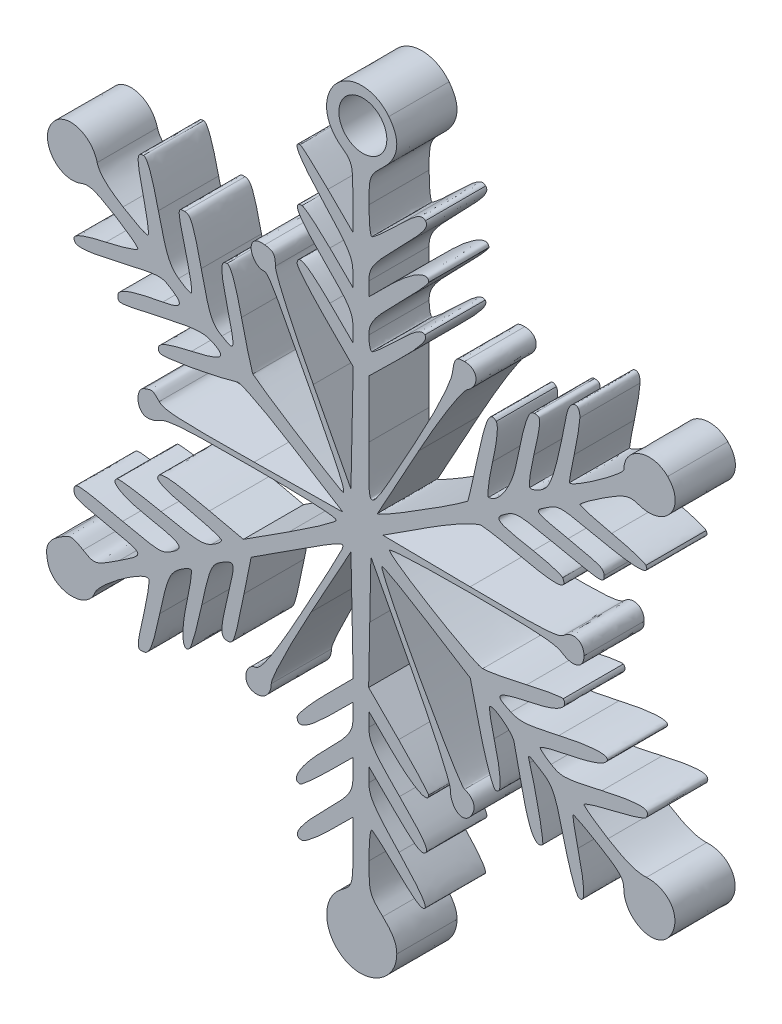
SolidWorks part; units mm, degrees
ref_plane "Front Plane" through (0, 0, 0) normal (0, 0, 1) x (1, 0, 0)
ref_plane "Top Plane" through (0, 0, 0) normal (0, 1, 0) x (1, 0, 0)
ref_plane "Right Plane" through (0, 0, 0) normal (1, 0, 0) x (0, 0, -1)
sketch "Model" plane through (0, 0, 0) normal (0, 0, 1) x (1, 0, 0)
  line L0 (27.5578, 9.3179) -> (27.5578, 11.3104)
  line L1 (27.5578, 11.3104) -> (26.0288, 9.7973)
  line L2 (27.5578, 13.6934) -> (27.5578, 14.7512)
  line L3 (27.5578, 14.7512) -> (25.897, 13.1052)
  line L4 (27.5578, 17.0001) -> (27.5578, 17.9249)
  line L5 (27.5578, 17.9249) -> (26.0288, 16.4119)
  line L6 (25.7135, 17.4202) -> (27.5734, 19.2926)
  line L7 (27.5734, 19.2926) -> (27.4994, 22.8982)
  line L8 (27.4994, 22.8982) -> (27.4255, 26.5037)
  line L9 (27.4255, 26.5037) -> (24.7797, 21.7193)
  line L10 (22.9202, 24.2573) -> (20.7962, 22.8796)
  line L11 (20.7962, 22.8796) -> (20.3236, 20.5429)
  line L12 (18.0327, 24.1638) -> (20.2817, 23.6528)
  line L13 (20.2817, 23.6528) -> (23.3169, 25.6034)
  line L14 (20.9953, 28.4536) -> (26.8959, 28.5248)
  line L15 (26.8959, 28.5248) -> (23.6059, 30.5775)
  line L16 (24.9227, 34.8786) -> (27.4255, 30.1199)
  line L17 (27.4255, 30.1199) -> (27.4997, 33.6736)
  line L18 (27.4997, 33.6736) -> (27.5739, 37.2274)
  line L19 (27.5739, 37.2274) -> (25.7138, 39.1)
  line L20 (26.0288, 40.1086) -> (27.5578, 38.5955)
  line L21 (27.5578, 38.5955) -> (27.5578, 39.5203)
  line L22 (26.0288, 43.2836) -> (27.5578, 41.7705)
  line L23 (27.5578, 41.7705) -> (27.5538, 42.6883)
  line L24 (25.897, 46.5902) -> (27.5578, 44.9442)
  line L25 (27.5578, 44.9442) -> (27.5578, 46.9373)
  line L26 (28.6161, 42.6824) -> (28.6161, 41.7705)
  line L27 (28.6161, 41.7705) -> (30.1452, 43.2836)
  line L28 (30.6219, 39.1883) -> (28.6161, 37.2211)
  line L29 (28.6161, 37.2211) -> (28.6161, 33.4094)
  line L30 (32.5184, 30.443) -> (29.5495, 28.5248)
  line L31 (29.5495, 28.5248) -> (35.34, 28.4534)
  line L32 (36.0176, 20.463) -> (35.3494, 23.2086)
  line L33 (35.3494, 23.2086) -> (32.4803, 25.0194)
  line L34 (31.3846, 21.8829) -> (28.7484, 26.8825)
  line L35 (28.7484, 26.8825) -> (28.6747, 23.0869)
  line L36 (28.6747, 23.0869) -> (28.601, 19.2914)
  line L37 (28.601, 19.2914) -> (30.593, 17.2877)
  line L38 (30.1452, 16.4119) -> (28.6162, 17.9249)
  line L39 (28.6162, 17.9249) -> (28.6162, 17.013)
  line L40 (30.3332, 13.0495) -> (28.6162, 14.7512)
  line L41 (28.6162, 14.7512) -> (28.6212, 13.8328)
  line L42 (0.1159, 55.7641) -> (55.7641, 55.7641)
  line L43 (55.7641, 55.7641) -> (55.7641, 0.1159)
  line L44 (55.7641, 0.1159) -> (0.1159, 0.1159)
  line L45 (0.1159, 0.1159) -> (0.1159, 55.7641)
  spline S0 degree 3 poles (26.999, 2.8494) (25.5131, 3.6801) (25.4069, 5.7352) (26.7968, 6.7628) knots 0 0 0 0 1 1 1 1
  spline S1 degree 3 poles (26.7968, 6.7628) (27.5179, 7.2959) (27.5578, 7.4299) (27.5578, 9.3179) knots 0 0 0 0 1 1 1 1
  spline S2 degree 3 poles (26.0288, 9.7973) (25.1878, 8.9651) (24.3544, 8.2842) (24.1767, 8.2842) knots 0 0 0 0 1 1 1 1
  spline S3 degree 3 poles (24.1767, 8.2842) (23.4749, 8.2842) (23.9351, 9.0407) (25.7057, 10.7978) knots 0 0 0 0 1 1 1 1
  spline S4 degree 3 poles (25.7057, 10.7978) (27.3835, 12.4626) (27.5578, 12.7352) (27.5578, 13.6934) knots 0 0 0 0 1 1 1 1
  spline S5 degree 3 poles (25.897, 13.1052) (24.9836, 12.1999) (24.1502, 11.4592) (24.0449, 11.4592) knots 0 0 0 0 1 1 1 1
  spline S6 degree 3 poles (24.0449, 11.4592) (23.3944, 11.4592) (24.1064, 12.6503) (25.7057, 14.2373) knots 0 0 0 0 1 1 1 1
  spline S7 degree 3 poles (25.7057, 14.2373) (27.295, 15.8145) (27.5578, 16.2064) (27.5578, 17.0001) knots 0 0 0 0 1 1 1 1
  spline S8 degree 3 poles (26.0288, 16.4119) (24.5394, 14.9381) (23.8536, 14.5633) (23.8536, 15.2233) knots 0 0 0 0 1 1 1 1
  spline S9 degree 3 poles (23.8536, 15.2233) (23.8536, 15.4018) (24.6906, 16.3904) (25.7135, 17.4202) knots 0 0 0 0 1 1 1 1
  spline S10 degree 3 poles (24.7797, 21.7193) (23.3245, 19.0879) (22.1338, 16.6392) (22.1338, 16.2778) knots 0 0 0 0 1 1 1 1
  spline S11 degree 3 poles (22.1338, 16.2778) (22.1338, 15.5157) (21.4801, 15.0023) (20.8283, 15.2524) knots 0 0 0 0 1 1 1 1
  spline S12 degree 3 poles (20.8283, 15.2524) (20.2016, 15.4929) (20.3905, 16.596) (21.0755, 16.6954) knots 0 0 0 0 1 1 1 1
  spline S13 degree 3 poles (21.0755, 16.6954) (21.4574, 16.7509) (22.3043, 18.0355) (24.1182, 21.3107) knots 0 0 0 0 1 1 1 1
  spline S14 degree 3 poles (24.1182, 21.3107) (25.5007, 23.8068) (26.7207, 26.0736) (26.8295, 26.3482) knots 0 0 0 0 1 1 1 1
  spline S15 degree 3 poles (26.8295, 26.3482) (27.0546, 26.9164) (26.8565, 26.8104) (22.9202, 24.2573) knots 0 0 0 0 1 1 1 1
  spline S16 degree 3 poles (20.3236, 20.5429) (19.6919, 17.4194) (19.6441, 17.2801) (19.2056, 17.2801) knots 0 0 0 0 1 1 1 1
  spline S17 degree 3 poles (19.2056, 17.2801) (18.7356, 17.2801) (18.7402, 17.7703) (19.2287, 19.7936) knots 0 0 0 0 1 1 1 1
  spline S18 degree 3 poles (19.2287, 19.7936) (19.7778, 22.0678) (19.7599, 22.155) (18.8542, 21.6199) knots 0 0 0 0 1 1 1 1
  spline S19 degree 3 poles (18.8542, 21.6199) (18.1697, 21.2156) (18.0277, 20.8835) (17.5197, 18.4978) knots 0 0 0 0 1 1 1 1
  spline S20 degree 3 poles (17.5197, 18.4978) (17.2071, 17.0295) (16.8413, 15.7182) (16.7069, 15.5838) knots 0 0 0 0 1 1 1 1
  spline S21 degree 3 poles (16.7069, 15.5838) (16.2054, 15.0822) (16.1182, 16.307) (16.5239, 18.1559) knots 0 0 0 0 1 1 1 1
  spline S22 degree 3 poles (16.5239, 18.1559) (16.7524, 19.1972) (16.8857, 20.1028) (16.8203, 20.1683) knots 0 0 0 0 1 1 1 1
  spline S23 degree 3 poles (16.8203, 20.1683) (16.7548, 20.2338) (16.3815, 20.0487) (15.9908, 19.757) knots 0 0 0 0 1 1 1 1
  spline S24 degree 3 poles (15.9908, 19.757) (15.3959, 19.3128) (15.1908, 18.8002) (14.7283, 16.6014) knots 0 0 0 0 1 1 1 1
  spline S25 degree 3 poles (14.7283, 16.6014) (14.3094, 14.6101) (14.0666, 13.955) (13.7231, 13.8889) knots 0 0 0 0 1 1 1 1
  spline S26 degree 3 poles (13.7231, 13.8889) (13.1676, 13.7819) (13.1669, 13.8472) (13.6987, 16.2018) knots 0 0 0 0 1 1 1 1
  spline S27 degree 3 poles (13.6987, 16.2018) (13.9343, 17.2452) (14.0653, 18.1607) (13.9898, 18.2362) knots 0 0 0 0 1 1 1 1
  spline S28 degree 3 poles (13.9898, 18.2362) (13.6854, 18.5406) (10.703, 16.3871) (10.4309, 15.6664) knots 0 0 0 0 1 1 1 1
  spline S29 degree 3 poles (10.4309, 15.6664) (9.908, 14.281) (7.6541, 14.388) (7.2959, 15.8153) knots 0 0 0 0 1 1 1 1
  spline S30 degree 3 poles (7.2959, 15.8153) (7.0739, 16.6997) (7.2726, 17.152) (8.1296, 17.7136) knots 0 0 0 0 1 1 1 1
  spline S31 degree 3 poles (8.1296, 17.7136) (8.8026, 18.1545) (8.8785, 18.1548) (9.6368, 17.7195) knots 0 0 0 0 1 1 1 1
  spline S32 degree 3 poles (9.6368, 17.7195) (10.4338, 17.2622) (10.4387, 17.2634) (12.0404, 18.316) knots 0 0 0 0 1 1 1 1
  spline S33 degree 3 poles (12.0404, 18.316) (13.7655, 19.4496) (13.7733, 19.4295) (11.4181, 19.9284) knots 0 0 0 0 1 1 1 1
  spline S34 degree 3 poles (11.4181, 19.9284) (9.1967, 20.399) (9.0369, 20.4621) (9.0369, 20.8697) knots 0 0 0 0 1 1 1 1
  spline S35 degree 3 poles (9.0369, 20.8697) (9.0369, 21.3661) (9.2374, 21.3544) (12.2629, 20.6808) knots 0 0 0 0 1 1 1 1
  spline S36 degree 3 poles (12.2629, 20.6808) (14.7275, 20.132) (14.8552, 20.1279) (15.5389, 20.5759) knots 0 0 0 0 1 1 1 1
  spline S37 degree 3 poles (15.5389, 20.5759) (16.4283, 21.1586) (16.1568, 21.3581) (13.8927, 21.7853) knots 0 0 0 0 1 1 1 1
  spline S38 degree 3 poles (13.8927, 21.7853) (12.3091, 22.0841) (11.3807, 22.6184) (11.8939, 22.9355) knots 0 0 0 0 1 1 1 1
  spline S39 degree 3 poles (11.8939, 22.9355) (12.0242, 23.0161) (13.3388, 22.8275) (14.8153, 22.5165) knots 0 0 0 0 1 1 1 1
  spline S40 degree 3 poles (14.8153, 22.5165) (17.126, 22.0299) (17.5923, 22.0006) (18.1632, 22.3061) knots 0 0 0 0 1 1 1 1
  spline S41 degree 3 poles (18.1632, 22.3061) (18.528, 22.5014) (18.8265, 22.7542) (18.8265, 22.8681) knots 0 0 0 0 1 1 1 1
  spline S42 degree 3 poles (18.8265, 22.8681) (18.8265, 22.9819) (17.874, 23.2797) (16.7098, 23.5299) knots 0 0 0 0 1 1 1 1
  spline S43 degree 3 poles (16.7098, 23.5299) (15.3533, 23.8214) (14.5931, 24.1111) (14.5931, 24.3365) knots 0 0 0 0 1 1 1 1
  spline S44 degree 3 poles (14.5931, 24.3365) (14.5931, 24.8096) (15.3597, 24.7711) (18.0327, 24.1638) knots 0 0 0 0 1 1 1 1
  spline S45 degree 3 poles (23.3169, 25.6034) (24.9863, 26.6761) (26.3933, 27.6774) (26.4436, 27.8284) knots 0 0 0 0 1 1 1 1
  spline S46 degree 3 poles (26.4436, 27.8284) (26.505, 28.0121) (24.6849, 28.1037) (20.9365, 28.1054) knots 0 0 0 0 1 1 1 1
  spline S47 degree 3 poles (20.9365, 28.1054) (16.4274, 28.1074) (15.2212, 28.0315) (14.7382, 27.7151) knots 0 0 0 0 1 1 1 1
  spline S48 degree 3 poles (14.7382, 27.7151) (14.4084, 27.499) (13.9432, 27.3972) (13.7044, 27.4888) knots 0 0 0 0 1 1 1 1
  spline S49 degree 3 poles (13.7044, 27.4888) (13.1497, 27.7016) (13.1383, 28.8144) (13.6888, 29.0257) knots 0 0 0 0 1 1 1 1
  spline S50 degree 3 poles (13.6888, 29.0257) (14.2479, 29.2402) (14.2334, 29.2437) (14.6928, 28.7843) knots 0 0 0 0 1 1 1 1
  spline S51 degree 3 poles (14.6928, 28.7843) (15.0328, 28.4443) (16.0039, 28.3933) (20.9953, 28.4536) knots 0 0 0 0 1 1 1 1
  spline S52 degree 3 poles (23.6059, 30.5775) (21.7963, 31.7066) (20.1296, 32.574) (19.9019, 32.5052) knots 0 0 0 0 1 1 1 1
  spline S53 degree 3 poles (19.9019, 32.5052) (18.2169, 31.9959) (14.8275, 31.4025) (14.708, 31.5958) knots 0 0 0 0 1 1 1 1
  spline S54 degree 3 poles (14.708, 31.5958) (14.4198, 32.0621) (14.8866, 32.3145) (16.8412, 32.7494) knots 0 0 0 0 1 1 1 1
  spline S55 degree 3 poles (16.8412, 32.7494) (18.9401, 33.2163) (19.2454, 33.5046) (18.1632, 33.9977) knots 0 0 0 0 1 1 1 1
  spline S56 degree 3 poles (18.1632, 33.9977) (17.6331, 34.2392) (16.982, 34.1846) (14.9221, 33.726) knots 0 0 0 0 1 1 1 1
  spline S57 degree 3 poles (14.9221, 33.726) (11.8691, 33.0462) (11.9473, 33.051) (11.9473, 33.5417) knots 0 0 0 0 1 1 1 1
  spline S58 degree 3 poles (11.9473, 33.5417) (11.9473, 33.9215) (12.8616, 34.2537) (14.9268, 34.624) knots 0 0 0 0 1 1 1 1
  spline S59 degree 3 poles (14.9268, 34.624) (16.2022, 34.8527) (16.3414, 35.1054) (15.4971, 35.6587) knots 0 0 0 0 1 1 1 1
  spline S60 degree 3 poles (15.4971, 35.6587) (14.8563, 36.0785) (14.6837, 36.0727) (12.4367, 35.5554) knots 0 0 0 0 1 1 1 1
  spline S61 degree 3 poles (12.4367, 35.5554) (9.6458, 34.9128) (9.0369, 34.8788) (9.0369, 35.3657) knots 0 0 0 0 1 1 1 1
  spline S62 degree 3 poles (9.0369, 35.3657) (9.0369, 35.5994) (9.7739, 35.8835) (11.1536, 36.1816) knots 0 0 0 0 1 1 1 1
  spline S63 degree 3 poles (11.1536, 36.1816) (12.3178, 36.4331) (13.2703, 36.7394) (13.2703, 36.8622) knots 0 0 0 0 1 1 1 1
  spline S64 degree 3 poles (13.2703, 36.8622) (13.2703, 36.985) (12.5676, 37.5122) (11.7088, 38.034) knots 0 0 0 0 1 1 1 1
  spline S65 degree 3 poles (11.7088, 38.034) (10.4299, 38.8108) (10.0302, 38.9379) (9.4999, 38.7363) knots 0 0 0 0 1 1 1 1
  spline S66 degree 3 poles (9.4999, 38.7363) (8.0259, 38.1759) (6.6759, 39.8793) (7.544, 41.2043) knots 0 0 0 0 1 1 1 1
  spline S67 degree 3 poles (7.544, 41.2043) (8.3465, 42.4291) (10.1661, 41.9882) (10.5719, 40.4706) knots 0 0 0 0 1 1 1 1
  spline S68 degree 3 poles (10.5719, 40.4706) (10.7133, 39.9419) (11.2258, 39.4362) (12.2893, 38.776) knots 0 0 0 0 1 1 1 1
  spline S69 degree 3 poles (12.2893, 38.776) (13.123, 38.2585) (13.8693, 37.8991) (13.9476, 37.9774) knots 0 0 0 0 1 1 1 1
  spline S70 degree 3 poles (13.9476, 37.9774) (14.0259, 38.0557) (13.9056, 38.9151) (13.6801, 39.8872) knots 0 0 0 0 1 1 1 1
  spline S71 degree 3 poles (13.6801, 39.8872) (13.1751, 42.0648) (13.17, 42.4154) (13.6434, 42.4154) knots 0 0 0 0 1 1 1 1
  spline S72 degree 3 poles (13.6434, 42.4154) (13.8993, 42.4154) (14.211, 41.5722) (14.6356, 39.7315) knots 0 0 0 0 1 1 1 1
  spline S73 degree 3 poles (14.6356, 39.7315) (15.1508, 37.4977) (15.376, 36.957) (15.9779, 36.508) knots 0 0 0 0 1 1 1 1
  spline S74 degree 3 poles (15.9779, 36.508) (16.3758, 36.2113) (16.7579, 36.0252) (16.8271, 36.0944) knots 0 0 0 0 1 1 1 1
  spline S75 degree 3 poles (16.8271, 36.0944) (16.8963, 36.1636) (16.7914, 36.87) (16.594, 37.6642) knots 0 0 0 0 1 1 1 1
  spline S76 degree 3 poles (16.594, 37.6642) (15.8631, 40.6047) (15.8661, 40.5633) (16.3903, 40.5633) knots 0 0 0 0 1 1 1 1
  spline S77 degree 3 poles (16.3903, 40.5633) (16.7892, 40.5633) (16.9817, 40.0809) (17.4823, 37.8253) knots 0 0 0 0 1 1 1 1
  spline S78 degree 3 poles (17.4823, 37.8253) (18.0239, 35.3853) (18.1733, 35.0382) (18.8552, 34.6354) knots 0 0 0 0 1 1 1 1
  spline S79 degree 3 poles (18.8552, 34.6354) (19.7556, 34.1035) (19.7701, 34.1765) (19.2181, 36.4623) knots 0 0 0 0 1 1 1 1
  spline S80 degree 3 poles (19.2181, 36.4623) (18.7362, 38.4582) (18.7314, 38.9758) (19.1946, 38.9758) knots 0 0 0 0 1 1 1 1
  spline S81 degree 3 poles (19.1946, 38.9758) (19.4441, 38.9758) (19.754, 38.1313) (20.1574, 36.3521) knots 0 0 0 0 1 1 1 1
  spline S82 degree 3 poles (20.1574, 36.3521) (20.4846, 34.9091) (20.825, 33.6177) (20.9139, 33.4823) knots 0 0 0 0 1 1 1 1
  spline S83 degree 3 poles (20.9139, 33.4823) (21.066, 33.2505) (25.5549, 30.3625) (26.7929, 29.7) knots 0 0 0 0 1 1 1 1
  spline S84 degree 3 poles (26.7929, 29.7) (27.227, 29.4676) (26.7755, 30.5238) (24.9036, 34.1191) knots 0 0 0 0 1 1 1 1
  spline S85 degree 3 poles (24.9036, 34.1191) (21.9851, 39.7246) (21.9586, 39.7696) (21.5734, 39.7696) knots 0 0 0 0 1 1 1 1
  spline S86 degree 3 poles (21.5734, 39.7696) (21.0874, 39.7696) (20.6554, 40.4596) (20.8401, 40.941) knots 0 0 0 0 1 1 1 1
  spline S87 degree 3 poles (20.8401, 40.941) (20.9529, 41.2348) (21.2461, 41.3584) (21.7046, 41.3052) knots 0 0 0 0 1 1 1 1
  spline S88 degree 3 poles (21.7046, 41.3052) (22.2783, 41.2387) (22.4003, 41.0873) (22.4092, 40.431) knots 0 0 0 0 1 1 1 1
  spline S89 degree 3 poles (22.4092, 40.431) (22.4151, 39.9562) (23.4254, 37.7255) (24.9227, 34.8786) knots 0 0 0 0 1 1 1 1
  spline S90 degree 3 poles (25.7138, 39.1) (24.6907, 40.1299) (23.8536, 41.1187) (23.8536, 41.2971) knots 0 0 0 0 1 1 1 1
  spline S91 degree 3 poles (23.8536, 41.2971) (23.8536, 41.9571) (24.5395, 41.5823) (26.0288, 40.1086) knots 0 0 0 0 1 1 1 1
  spline S92 degree 3 poles (27.5578, 39.5203) (27.5578, 40.314) (27.295, 40.706) (25.7057, 42.2831) knots 0 0 0 0 1 1 1 1
  spline S93 degree 3 poles (25.7057, 42.2831) (23.9351, 44.0402) (23.4749, 44.7966) (24.1767, 44.7966) knots 0 0 0 0 1 1 1 1
  spline S94 degree 3 poles (24.1767, 44.7966) (24.3544, 44.7966) (25.1878, 44.1158) (26.0288, 43.2836) knots 0 0 0 0 1 1 1 1
  spline S95 degree 3 poles (27.5538, 42.6883) (27.5508, 43.4555) (27.2473, 43.9315) (25.7057, 45.5904) knots 0 0 0 0 1 1 1 1
  spline S96 degree 3 poles (25.7057, 45.5904) (24.0432, 47.3793) (23.5053, 48.2362) (24.0449, 48.2362) knots 0 0 0 0 1 1 1 1
  spline S97 degree 3 poles (24.0449, 48.2362) (24.1502, 48.2362) (24.9836, 47.4955) (25.897, 46.5902) knots 0 0 0 0 1 1 1 1
  spline S98 degree 3 poles (27.5578, 46.9373) (27.5578, 48.8319) (27.5197, 48.9587) (26.7871, 49.5003) knots 0 0 0 0 1 1 1 1
  spline S99 degree 3 poles (26.7871, 49.5003) (25.819, 50.216) (25.5355, 51.373) (26.0733, 52.413) knots 0 0 0 0 1 1 1 1
  spline S100 degree 3 poles (26.0733, 52.413) (26.8562, 53.9268) (28.8967, 54.1314) (29.9432, 52.801) knots 0 0 0 0 1 1 1 1
  spline S101 degree 3 poles (29.9432, 52.801) (30.7604, 51.7622) (30.6234, 50.694) (29.5422, 49.6743) knots 0 0 0 0 1 1 1 1
  spline S102 degree 3 poles (29.5422, 49.6743) (28.6665, 48.8484) (28.6161, 48.7064) (28.6161, 47.0634) knots 0 0 0 0 1 1 1 1
  spline S103 degree 3 poles (28.6161, 47.0634) (28.6161, 46.1077) (28.702, 45.3258) (28.8069, 45.3258) knots 0 0 0 0 1 1 1 1
  spline S104 degree 3 poles (28.8069, 45.3258) (28.9118, 45.3258) (29.6846, 46.0056) (30.5242, 46.8364) knots 0 0 0 0 1 1 1 1
  spline S105 degree 3 poles (30.5242, 46.8364) (31.7272, 48.0269) (32.1193, 48.2785) (32.3742, 48.0235) knots 0 0 0 0 1 1 1 1
  spline S106 degree 3 poles (32.3742, 48.0235) (32.6292, 47.7686) (32.2653, 47.265) (30.6569, 45.6472) knots 0 0 0 0 1 1 1 1
  spline S107 degree 3 poles (30.6569, 45.6472) (28.9041, 43.884) (28.6161, 43.4656) (28.6161, 42.6824) knots 0 0 0 0 1 1 1 1
  spline S108 degree 3 poles (30.1452, 43.2836) (31.4921, 44.6164) (32.5849, 45.2023) (32.5849, 44.5916) knots 0 0 0 0 1 1 1 1
  spline S109 degree 3 poles (32.5849, 44.5916) (32.5849, 44.4788) (31.6919, 43.4995) (30.6005, 42.4154) knots 0 0 0 0 1 1 1 1
  spline S110 degree 3 poles (30.6005, 42.4154) (28.9362, 40.7622) (28.6161, 40.3045) (28.6161, 39.5777) knots 0 0 0 0 1 1 1 1
  spline S111 degree 3 poles (28.6161, 39.5777) (28.6161, 39.1012) (28.702, 38.7112) (28.8069, 38.7112) knots 0 0 0 0 1 1 1 1
  spline S112 degree 3 poles (28.8069, 38.7112) (28.9118, 38.7112) (29.6846, 39.391) (30.5242, 40.2218) knots 0 0 0 0 1 1 1 1
  spline S113 degree 3 poles (30.5242, 40.2218) (31.6263, 41.3124) (32.1309, 41.6522) (32.3392, 41.4439) knots 0 0 0 0 1 1 1 1
  spline S114 degree 3 poles (32.3392, 41.4439) (32.5475, 41.2357) (32.07, 40.6085) (30.6219, 39.1883) knots 0 0 0 0 1 1 1 1
  spline S115 degree 3 poles (28.6161, 33.4094) (28.6161, 28.973) (28.3097, 28.8257) (31.6651, 34.8748) knots 0 0 0 0 1 1 1 1
  spline S116 degree 3 poles (31.6651, 34.8748) (33.0704, 37.4082) (34.0719, 39.5331) (34.159, 40.1664) knots 0 0 0 0 1 1 1 1
  spline S117 degree 3 poles (34.159, 40.1664) (34.2848, 41.0801) (34.3951, 41.2248) (34.9661, 41.2248) knots 0 0 0 0 1 1 1 1
  spline S118 degree 3 poles (34.9661, 41.2248) (35.887, 41.2248) (36.0051, 40.2556) (35.1522, 39.6968) knots 0 0 0 0 1 1 1 1
  spline S119 degree 3 poles (35.1522, 39.6968) (34.7954, 39.4631) (33.3831, 37.2179) (31.9236, 34.5645) knots 0 0 0 0 1 1 1 1
  spline S120 degree 3 poles (31.9236, 34.5645) (30.4967, 31.9702) (29.2667, 29.7357) (29.1904, 29.5987) knots 0 0 0 0 1 1 1 1
  spline S121 degree 3 poles (29.1904, 29.5987) (29.0207, 29.2943) (33.7059, 32.1854) (35.1704, 33.2888) knots 0 0 0 0 1 1 1 1
  spline S122 degree 3 poles (35.1704, 33.2888) (35.21, 33.3186) (35.4918, 34.5211) (35.7968, 35.9609) knots 0 0 0 0 1 1 1 1
  spline S123 degree 3 poles (35.7968, 35.9609) (36.372, 38.6774) (36.6334, 39.2668) (37.0691, 38.8303) knots 0 0 0 0 1 1 1 1
  spline S124 degree 3 poles (37.0691, 38.8303) (37.2273, 38.6718) (37.1401, 37.7722) (36.8332, 36.3961) knots 0 0 0 0 1 1 1 1
  spline S125 degree 3 poles (36.8332, 36.3961) (36.5654, 35.1956) (36.4459, 34.2133) (36.5675, 34.2133) knots 0 0 0 0 1 1 1 1
  spline S126 degree 3 poles (36.5675, 34.2133) (37.237, 34.2133) (38.0958, 35.521) (38.3921, 36.9914) knots 0 0 0 0 1 1 1 1
  spline S127 degree 3 poles (38.3921, 36.9914) (38.9702, 39.8604) (39.2091, 40.5633) (39.6065, 40.5633) knots 0 0 0 0 1 1 1 1
  spline S128 degree 3 poles (39.6065, 40.5633) (40.0906, 40.5633) (40.0885, 40.4254) (39.5708, 38.1495) knots 0 0 0 0 1 1 1 1
  spline S129 degree 3 poles (39.5708, 38.1495) (39.3386, 37.1282) (39.2158, 36.2254) (39.298, 36.1432) knots 0 0 0 0 1 1 1 1
  spline S130 degree 3 poles (39.298, 36.1432) (39.3802, 36.061) (39.7356, 36.1825) (40.0877, 36.4132) knots 0 0 0 0 1 1 1 1
  spline S131 degree 3 poles (40.0877, 36.4132) (40.7053, 36.8179) (41.0045, 37.7466) (41.7444, 41.5555) knots 0 0 0 0 1 1 1 1
  spline S132 degree 3 poles (41.7444, 41.5555) (41.933, 42.5267) (42.6441, 42.7392) (42.6297, 41.8201) knots 0 0 0 0 1 1 1 1
  spline S133 degree 3 poles (42.6297, 41.8201) (42.6247, 41.4927) (42.4548, 40.452) (42.2523, 39.5075) knots 0 0 0 0 1 1 1 1
  spline S134 degree 3 poles (42.2523, 39.5075) (42.0499, 38.563) (41.9079, 37.7667) (41.9367, 37.7378) knots 0 0 0 0 1 1 1 1
  spline S135 degree 3 poles (41.9367, 37.7378) (42.1275, 37.547) (45.5494, 39.9768) (45.5494, 40.3031) knots 0 0 0 0 1 1 1 1
  spline S136 degree 3 poles (45.5494, 40.3031) (45.5494, 41.7142) (47.4239, 42.393) (48.4598, 41.3571) knots 0 0 0 0 1 1 1 1
  spline S137 degree 3 poles (48.4598, 41.3571) (49.7516, 40.0653) (48.3283, 38.1511) (46.5397, 38.7746) knots 0 0 0 0 1 1 1 1
  spline S138 degree 3 poles (46.5397, 38.7746) (45.9091, 38.9944) (45.588, 38.8884) (44.2255, 38.0106) knots 0 0 0 0 1 1 1 1
  spline S139 degree 3 poles (44.2255, 38.0106) (43.3555, 37.4501) (42.6426, 36.9224) (42.6413, 36.8381) knots 0 0 0 0 1 1 1 1
  spline S140 degree 3 poles (42.6413, 36.8381) (42.6403, 36.7536) (43.5875, 36.4809) (44.7468, 36.2317) knots 0 0 0 0 1 1 1 1
  spline S141 degree 3 poles (44.7468, 36.2317) (45.9062, 35.9826) (46.9258, 35.6638) (47.0126, 35.5233) knots 0 0 0 0 1 1 1 1
  spline S142 degree 3 poles (47.0126, 35.5233) (47.3437, 34.9876) (46.2987, 34.9879) (43.8234, 35.5242) knots 0 0 0 0 1 1 1 1
  spline S143 degree 3 poles (43.8234, 35.5242) (41.2643, 36.0786) (41.255, 36.0787) (40.433, 35.5583) knots 0 0 0 0 1 1 1 1
  spline S144 degree 3 poles (40.433, 35.5583) (39.516, 34.9776) (39.5318, 34.9655) (41.8452, 34.4754) knots 0 0 0 0 1 1 1 1
  spline S145 degree 3 poles (41.8452, 34.4754) (44.0667, 34.0048) (44.2265, 33.9416) (44.2265, 33.534) knots 0 0 0 0 1 1 1 1
  spline S146 degree 3 poles (44.2265, 33.534) (44.2265, 33.049) (44.2107, 33.05) (41.0684, 33.7191) knots 0 0 0 0 1 1 1 1
  spline S147 degree 3 poles (41.0684, 33.7191) (38.5271, 34.2602) (38.3905, 34.2642) (37.7103, 33.8186) knots 0 0 0 0 1 1 1 1
  spline S148 degree 3 poles (37.7103, 33.8186) (36.8298, 33.2417) (37.0743, 33.0823) (39.5334, 32.6295) knots 0 0 0 0 1 1 1 1
  spline S149 degree 3 poles (39.5334, 32.6295) (40.5175, 32.4483) (41.3941, 32.1844) (41.4815, 32.043) knots 0 0 0 0 1 1 1 1
  spline S150 degree 3 poles (41.4815, 32.043) (41.8615, 31.4283) (41.0412, 31.3625) (38.9348, 31.839) knots 0 0 0 0 1 1 1 1
  spline S151 degree 3 poles (38.9348, 31.839) (37.6979, 32.1188) (36.4162, 32.3507) (36.0865, 32.3545) knots 0 0 0 0 1 1 1 1
  spline S152 degree 3 poles (36.0865, 32.3545) (35.7569, 32.3585) (34.1512, 31.4981) (32.5184, 30.443) knots 0 0 0 0 1 1 1 1
  spline S153 degree 3 poles (35.34, 28.4534) (40.2582, 28.3927) (41.1985, 28.4434) (41.5819, 28.7905) knots 0 0 0 0 1 1 1 1
  spline S154 degree 3 poles (41.5819, 28.7905) (42.1703, 29.323) (42.9036, 29.0288) (42.9036, 28.2602) knots 0 0 0 0 1 1 1 1
  spline S155 degree 3 poles (42.9036, 28.2602) (42.9036, 27.4792) (42.198, 27.2155) (41.439, 27.7128) knots 0 0 0 0 1 1 1 1
  spline S156 degree 3 poles (41.439, 27.7128) (40.9619, 28.0254) (39.7491, 28.1038) (35.3724, 28.1049) knots 0 0 0 0 1 1 1 1
  spline S157 degree 3 poles (35.3724, 28.1049) (32.1949, 28.1057) (29.9376, 28.0052) (29.9867, 27.8652) knots 0 0 0 0 1 1 1 1
  spline S158 degree 3 poles (29.9867, 27.8652) (30.1514, 27.3958) (35.5513, 24.1592) (36.1697, 24.1592) knots 0 0 0 0 1 1 1 1
  spline S159 degree 3 poles (36.1697, 24.1592) (36.5151, 24.1592) (37.8313, 24.4002) (39.0946, 24.6947) knots 0 0 0 0 1 1 1 1
  spline S160 degree 3 poles (39.0946, 24.6947) (40.3579, 24.9893) (41.4487, 25.173) (41.5187, 25.103) knots 0 0 0 0 1 1 1 1
  spline S161 degree 3 poles (41.5187, 25.103) (41.9051, 24.7166) (41.1839, 24.2156) (39.8215, 23.9239) knots 0 0 0 0 1 1 1 1
  spline S162 degree 3 poles (39.8215, 23.9239) (37.005, 23.3208) (36.8023, 23.1695) (38.0489, 22.6016) knots 0 0 0 0 1 1 1 1
  spline S163 degree 3 poles (38.0489, 22.6016) (38.6277, 22.3378) (39.185, 22.3809) (41.2346, 22.8478) knots 0 0 0 0 1 1 1 1
  spline S164 degree 3 poles (41.2346, 22.8478) (43.8156, 23.4358) (45.0612, 23.3856) (44.1704, 22.7294) knots 0 0 0 0 1 1 1 1
  spline S165 degree 3 poles (44.1704, 22.7294) (43.9213, 22.5459) (42.8795, 22.2376) (41.8553, 22.0444) knots 0 0 0 0 1 1 1 1
  spline S166 degree 3 poles (41.8553, 22.0444) (40.8311, 21.8512) (39.9932, 21.6188) (39.9932, 21.5279) knots 0 0 0 0 1 1 1 1
  spline S167 degree 3 poles (39.9932, 21.5279) (39.9932, 21.4371) (40.3206, 21.1699) (40.7208, 20.9341) knots 0 0 0 0 1 1 1 1
  spline S168 degree 3 poles (40.7208, 20.9341) (41.4014, 20.5332) (41.6192, 20.5443) (44.0942, 21.1073) knots 0 0 0 0 1 1 1 1
  spline S169 degree 3 poles (44.0942, 21.1073) (46.5736, 21.6713) (47.4163, 21.6503) (47.0354, 21.034) knots 0 0 0 0 1 1 1 1
  spline S170 degree 3 poles (47.0354, 21.034) (46.9467, 20.8905) (45.9808, 20.5744) (44.8889, 20.3315) knots 0 0 0 0 1 1 1 1
  spline S171 degree 3 poles (44.8889, 20.3315) (43.797, 20.0885) (42.9049, 19.8086) (42.9065, 19.7094) knots 0 0 0 0 1 1 1 1
  spline S172 degree 3 poles (42.9065, 19.7094) (42.9085, 19.6102) (43.6248, 19.0862) (44.4991, 18.545) knots 0 0 0 0 1 1 1 1
  spline S173 degree 3 poles (44.4991, 18.545) (45.6413, 17.8381) (46.3596, 17.5713) (47.0507, 17.5972) knots 0 0 0 0 1 1 1 1
  spline S174 degree 3 poles (47.0507, 17.5972) (48.6394, 17.657) (49.4662, 16.227) (48.5771, 14.9576) knots 0 0 0 0 1 1 1 1
  spline S175 degree 3 poles (48.5771, 14.9576) (47.6543, 13.6401) (45.5584, 14.5084) (45.5436, 16.2144) knots 0 0 0 0 1 1 1 1
  spline S176 degree 3 poles (45.5436, 16.2144) (45.5386, 16.7494) (45.2106, 17.0792) (43.9008, 17.864) knots 0 0 0 0 1 1 1 1
  spline S177 degree 3 poles (43.9008, 17.864) (43.0003, 18.4035) (42.2264, 18.8077) (42.1809, 18.7622) knots 0 0 0 0 1 1 1 1
  spline S178 degree 3 poles (42.1809, 18.7622) (42.1354, 18.7167) (42.2776, 17.9181) (42.4969, 16.9875) knots 0 0 0 0 1 1 1 1
  spline S179 degree 3 poles (42.4969, 16.9875) (42.9903, 14.8944) (43.0138, 14.0248) (42.5728, 14.1693) knots 0 0 0 0 1 1 1 1
  spline S180 degree 3 poles (42.5728, 14.1693) (42.3909, 14.2289) (41.9445, 15.4943) (41.5807, 16.9813) knots 0 0 0 0 1 1 1 1
  spline S181 degree 3 poles (41.5807, 16.9813) (40.9745, 19.4588) (40.8446, 19.7319) (40.0267, 20.2489) knots 0 0 0 0 1 1 1 1
  spline S182 degree 3 poles (40.0267, 20.2489) (39.1761, 20.7863) (39.1416, 20.7889) (39.2916, 20.3032) knots 0 0 0 0 1 1 1 1
  spline S183 degree 3 poles (39.2916, 20.3032) (39.7005, 18.98) (40.2693, 16.1451) (40.1499, 16.0256) knots 0 0 0 0 1 1 1 1
  spline S184 degree 3 poles (40.1499, 16.0256) (39.7131, 15.5888) (39.2476, 16.4231) (38.8381, 18.3766) knots 0 0 0 0 1 1 1 1
  spline S185 degree 3 poles (38.8381, 18.3766) (38.5833, 19.5925) (38.3176, 20.785) (38.2476, 21.0267) knots 0 0 0 0 1 1 1 1
  spline S186 degree 3 poles (38.2476, 21.0267) (38.1124, 21.4938) (36.8572, 22.4343) (36.6481, 22.2252) knots 0 0 0 0 1 1 1 1
  spline S187 degree 3 poles (36.6481, 22.2252) (36.5798, 22.1569) (36.7092, 21.3861) (36.9356, 20.5123) knots 0 0 0 0 1 1 1 1
  spline S188 degree 3 poles (36.9356, 20.5123) (37.4404, 18.5642) (37.4712, 17.4599) (37.0166, 17.6089) knots 0 0 0 0 1 1 1 1
  spline S189 degree 3 poles (37.0166, 17.6089) (36.8347, 17.6685) (36.3852, 18.9529) (36.0176, 20.463) knots 0 0 0 0 1 1 1 1
  spline S190 degree 3 poles (32.4803, 25.0194) (30.9024, 26.0152) (29.5542, 26.773) (29.4844, 26.7032) knots 0 0 0 0 1 1 1 1
  spline S191 degree 3 poles (29.4844, 26.7032) (29.2309, 26.4497) (34.4985, 16.767) (34.9717, 16.6168) knots 0 0 0 0 1 1 1 1
  spline S192 degree 3 poles (34.9717, 16.6168) (35.629, 16.4082) (35.7922, 15.8364) (35.3603, 15.2552) knots 0 0 0 0 1 1 1 1
  spline S193 degree 3 poles (35.3603, 15.2552) (34.8505, 14.5692) (34.0433, 15.0932) (34.0304, 16.1186) knots 0 0 0 0 1 1 1 1
  spline S194 degree 3 poles (34.0304, 16.1186) (34.0244, 16.5617) (32.9121, 18.9859) (31.3846, 21.8829) knots 0 0 0 0 1 1 1 1
  spline S195 degree 3 poles (30.593, 17.2877) (31.6885, 16.1856) (32.5849, 15.1973) (32.5849, 15.0914) knots 0 0 0 0 1 1 1 1
  spline S196 degree 3 poles (32.5849, 15.0914) (32.5849, 14.4925) (31.481, 15.0904) (30.1452, 16.4119) knots 0 0 0 0 1 1 1 1
  spline S197 degree 3 poles (28.6162, 17.013) (28.6162, 16.2298) (28.9041, 15.8115) (30.657, 14.0483) knots 0 0 0 0 1 1 1 1
  spline S198 degree 3 poles (30.657, 14.0483) (32.2664, 12.4293) (32.6293, 11.927) (32.374, 11.6716) knots 0 0 0 0 1 1 1 1
  spline S199 degree 3 poles (32.374, 11.6716) (32.1186, 11.4162) (31.6872, 11.7075) (30.3332, 13.0495) knots 0 0 0 0 1 1 1 1
  spline S200 degree 3 poles (28.6212, 13.8328) (28.6252, 13.0553) (28.9311, 12.5928) (30.6129, 10.8184) knots 0 0 0 0 1 1 1 1
  spline S201 degree 3 poles (30.6129, 10.8184) (31.9852, 9.3706) (32.5148, 8.6374) (32.3252, 8.4479) knots 0 0 0 0 1 1 1 1
  spline S202 degree 3 poles (32.3252, 8.4479) (32.1356, 8.2583) (31.5786, 8.6406) (30.5242, 9.684) knots 0 0 0 0 1 1 1 1
  spline S203 degree 3 poles (30.5242, 9.684) (29.6846, 10.5148) (28.9118, 11.1946) (28.8069, 11.1946) knots 0 0 0 0 1 1 1 1
  spline S204 degree 3 poles (28.8069, 11.1946) (28.7019, 11.1946) (28.6161, 10.3532) (28.6161, 9.3248) knots 0 0 0 0 1 1 1 1
  spline S205 degree 3 poles (28.6161, 9.3248) (28.6161, 7.5305) (28.6536, 7.4196) (29.5422, 6.5815) knots 0 0 0 0 1 1 1 1
  spline S206 degree 3 poles (29.5422, 6.5815) (30.2105, 5.9512) (30.4682, 5.4817) (30.4682, 4.8943) knots 0 0 0 0 1 1 1 1
  spline S207 degree 3 poles (30.4682, 4.8943) (30.4682, 3.2058) (28.4693, 2.0276) (26.999, 2.8494) knots 0 0 0 0 1 1 1 1
  spline S208 degree 3 poles (29.3019, 4.1832) (29.7034, 4.7959) (29.7034, 4.8934) (29.3019, 5.5061) knots 0 0 0 0 1 1 1 1
  spline S209 degree 3 poles (29.3019, 5.5061) (28.8297, 6.2268) (27.6422, 6.4108) (27.0816, 5.8501) knots 0 0 0 0 1 1 1 1
  spline S210 degree 3 poles (27.0816, 5.8501) (26.6723, 5.4408) (26.6723, 4.2485) (27.0816, 3.8392) knots 0 0 0 0 1 1 1 1
  spline S211 degree 3 poles (27.0816, 3.8392) (27.6422, 3.2785) (28.8297, 3.4625) (29.3019, 4.1832) knots 0 0 0 0 1 1 1 1
  spline S212 degree 3 poles (47.7984, 15.9571) (47.7984, 16.7114) (46.9633, 17.0312) (46.711, 16.3736) knots 0 0 0 0 1 1 1 1
  spline S213 degree 3 poles (46.711, 16.3736) (46.4703, 15.7463) (46.8109, 15.1127) (47.3346, 15.2136) knots 0 0 0 0 1 1 1 1
  spline S214 degree 3 poles (47.3346, 15.2136) (47.6275, 15.27) (47.7984, 15.544) (47.7984, 15.9571) knots 0 0 0 0 1 1 1 1
  spline S215 degree 3 poles (9.514, 16.3216) (9.4642, 16.6707) (9.2086, 16.9152) (8.8385, 16.9677) knots 0 0 0 0 1 1 1 1
  spline S216 degree 3 poles (8.8385, 16.9677) (8.3581, 17.0359) (8.2432, 16.9253) (8.2432, 16.3945) knots 0 0 0 0 1 1 1 1
  spline S217 degree 3 poles (8.2432, 16.3945) (8.2432, 16.0327) (8.392, 15.6847) (8.5739, 15.6213) knots 0 0 0 0 1 1 1 1
  spline S218 degree 3 poles (8.5739, 15.6213) (9.1581, 15.4175) (9.5964, 15.7439) (9.514, 16.3216) knots 0 0 0 0 1 1 1 1
  spline S219 degree 3 poles (9.4339, 40.2988) (9.4339, 41.053) (8.5988, 41.3728) (8.3464, 40.7152) knots 0 0 0 0 1 1 1 1
  spline S220 degree 3 poles (8.3464, 40.7152) (8.1057, 40.0879) (8.4463, 39.4544) (8.97, 39.5553) knots 0 0 0 0 1 1 1 1
  spline S221 degree 3 poles (8.97, 39.5553) (9.2629, 39.6117) (9.4339, 39.8857) (9.4339, 40.2988) knots 0 0 0 0 1 1 1 1
  spline S222 degree 3 poles (47.7985, 40.2988) (47.7985, 41.053) (46.9634, 41.3728) (46.711, 40.7152) knots 0 0 0 0 1 1 1 1
  spline S223 degree 3 poles (46.711, 40.7152) (46.4703, 40.0879) (46.8109, 39.4544) (47.3347, 39.5553) knots 0 0 0 0 1 1 1 1
  spline S224 degree 3 poles (47.3347, 39.5553) (47.6275, 39.6117) (47.7985, 39.8857) (47.7985, 40.2988) knots 0 0 0 0 1 1 1 1
  spline S225 degree 3 poles (29.3019, 50.7498) (29.7034, 51.3626) (29.7034, 51.46) (29.3019, 52.0728) knots 0 0 0 0 1 1 1 1
  spline S226 degree 3 poles (29.3019, 52.0728) (28.8297, 52.7935) (27.6423, 52.9774) (27.0816, 52.4167) knots 0 0 0 0 1 1 1 1
  spline S227 degree 3 poles (27.0816, 52.4167) (26.6723, 52.0074) (26.6723, 50.8152) (27.0816, 50.4059) knots 0 0 0 0 1 1 1 1
  spline S228 degree 3 poles (27.0816, 50.4059) (27.6423, 49.8452) (28.8297, 50.0291) (29.3019, 50.7498) knots 0 0 0 0 1 1 1 1
extrude "Boss-Extrude1" add sketch "Model" along normal blind 4 contours L16 L17 L18 L19 S90 S91 L20 L21 S92 S93 S94 L22 L23 S95 S96 S97 L24 L25 S98 S99 S100 S101 S102 S103 S104 S105 S106 S107 L26 L27 S108 S109 S110 S111 S112 S113 S114 L28 L29 S115 S116 S117 S118 S119 S120 S121 S122 S123 S124 S125 S126 S127 S128 S129 S130 S131 S132 S133 S134 S135 S136 S137 S138 S139 S140 S141 S142 S143 S144 S145 S146 S147 S148 S149 S150 S151 S152 L30 L31 S153 S154 S155 S156 S157 S158 S159 S160 S161 S162 S163 S164 S165 S166 S167 S168 S169 S170 S171 S172 S173 S174 S175 S176 S177 S178 S179 S180 S181 S182 S183 S184 S185 S186 S187 S188 S189 L32 L33 S190 S191 S192 S193 S194 L34 L35 L36 L37 S195 S196 L38 L39 S197 S198 S199 L40 L41 S200 S201 S202 S203 S204 S205 S206 S207 S0 S1 L0 L1 S2 S3 S4 L2 L3 S5 S6 S7 L4 L5 S8 S9 L6 L7 L8 L9 S10 S11 S12 S13 S14 S15 L10 L11 S16 S17 S18 S19 S20 S21 S22 S23 S24 S25 S26 S27 S28 S29 S30 S31 S32 S33 S34 S35 S36 S37 S38 S39 S40 S41 S42 S43 S44 L12 L13 S45 S46 S47 S48 S49 S50 S51 L14 L15 S52 S53 S54 S55 S56 S57 S58 S59 S60 S61 S62 S63 S64 S65 S66 S67 S68 S69 S70 S71 S72 S73 S74 S75 S76 S77 S78 S79 S80 S81 S82 S83 S84 S85 S86 S87 S88 S89
sketch "Sketch3" plane through (0, 0, 0) normal (0, 0, -1) x (-1, 0, 0)
  circle A0 centre (-28.2143, 51.4123) radius 1.5922
  point P2 (0, 0)
extrude "Cut-Extrude1" cut sketch "Sketch3" against normal blind 4
